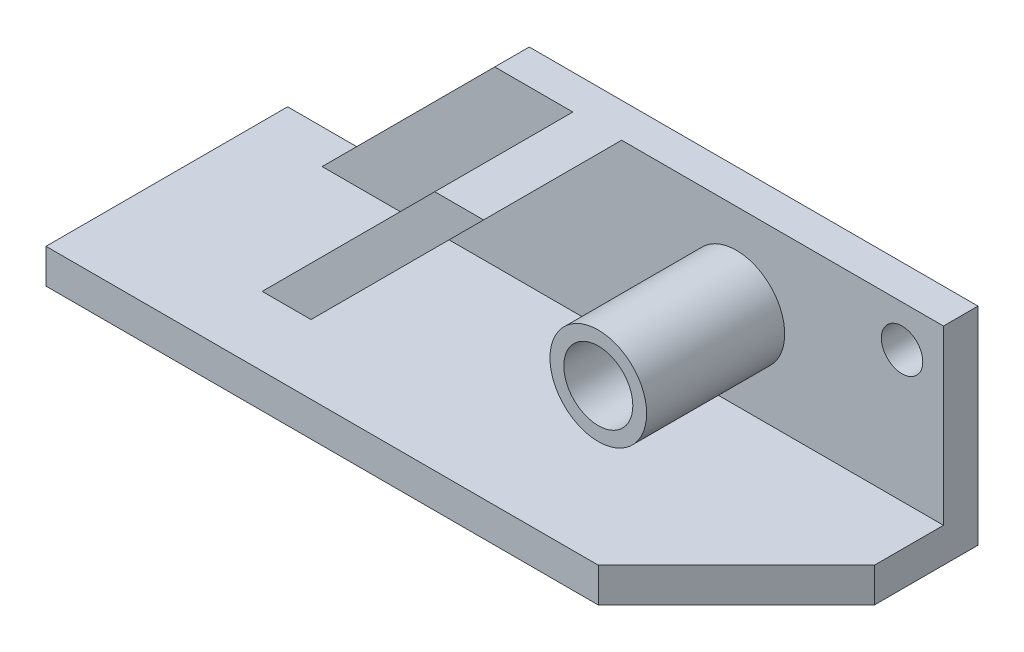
SolidWorks part; units mm, degrees
ref_plane "Front Plane" through (0, 0, 0) normal (0, 0, 1) x (1, 0, 0)
ref_plane "Top Plane" through (0, 0, 0) normal (0, 1, 0) x (1, 0, 0)
ref_plane "Right Plane" through (0, 0, 0) normal (1, 0, 0) x (0, 0, -1)
sketch "Sketch1" plane through (0, 0, 0) normal (0, 1, 0) x (1, 0, 0)
  line L0 (0, 0) -> (100, 0)
  line L1 (100, 0) -> (100, -15)
  line L2 (100, -15) -> (80, -35)
  line L3 (80, -35) -> (0, -35)
  line L4 (0, -35) -> (0, 0)
  dimension "D1" = 35
  dimension "D2" = 135
  dimension "D3" = 100
  dimension "D4" = 80
extrude "Extrude1" add sketch "Sketch1" along normal blind 5
sketch "Sketch2" plane through (0, 0, 0) normal (0, 0, 1) x (1, 0, 0)
  line L0 (10, 5) -> (100, 5)
  line L1 (0, 5) -> (80, 5) construction
  line L2 (100, 5) -> (100, 30)
  line L3 (100, 30) -> (35, 30)
  line L4 (35, 30) -> (10, 5)
  circle A0 centre (94, 24) radius 3
  dimension "D4" = 6
  dimension "D1" = 45
  dimension "D2" = 10
  dimension "D3" = 25
  dimension "D5" = 6
  dimension "D6" = 6
extrude "Extrude2" add sketch "Sketch2" along normal blind 5
sketch "Sketch3" plane through (0, 0, 5) normal (0, 0, 1) x (1, 0, 0)
  line L1 (46.3137, 30) -> (21.3137, 5)
  line L2 (100, 30) -> (35, 30) construction
  line L3 (0, 5) -> (80, 5) construction
  line L4 (21.3137, 5) -> (28.3848, 5)
  line L6 (100, 17.5) -> (70, 17.5) construction
  line L7 (100, 5) -> (100, 30) construction
  line L8 (28.3848, 5) -> (53.3848, 30)
  line L9 (53.3848, 30) -> (46.3137, 30)
  line L10 (35, 30) -> (10, 5) construction
  circle A0 centre (70, 17.5) radius 7
  circle A1 centre (70, 17.5) radius 5
  dimension "D2" = 14
  dimension "D5" = 10
  dimension "D1" = 8
  dimension "D3" = 30
  dimension "D4" = 5
extrude "Extrude3" add sketch "Sketch3" along normal blind 20
